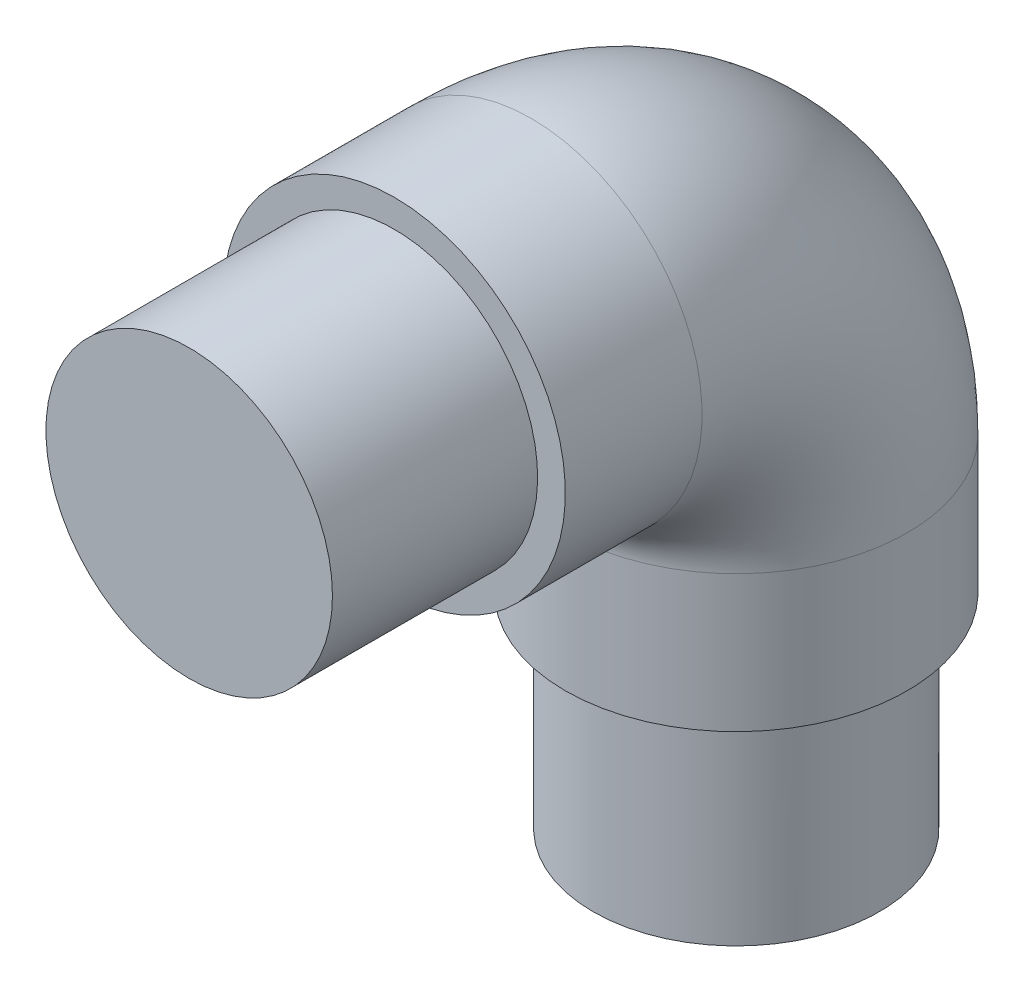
SolidWorks part; units mm, degrees
ref_plane "前视基准面" through (0, 0, 0) normal (0, 0, 1) x (1, 0, 0)
ref_plane "上视基准面" through (0, 0, 0) normal (0, 1, 0) x (1, 0, 0)
ref_plane "右视基准面" through (0, 0, 0) normal (1, 0, 0) x (0, 0, -1)
sketch "草图1" plane through (0, 0, 0) normal (0, 0, 1) x (1, 0, 0)
  circle A0 centre (0, 0) radius 10.475
  dimension "D1" = 20.95
extrude "凸台-拉伸1" add sketch "草图1" along normal blind 15
sketch "草图2" plane through (0, 0, 0) normal (1, 0, 0) x (0, 0, -1)
  line L0 (0, 0) -> (10, 0)
  line L1 (25, -15) -> (25, -25)
  arc A0 (10, 0) -> (25, -15) centre (10, -15) cw
  dimension "D1" = 15
sweep "扫描3" add path "草图2" parameters "D3"=25
sketch "草图70" plane through (0, -25, 0) normal (0, -1, 0) x (1, 0, 0)
  circle A0 centre (0, -25) radius 10.475
extrude "凸台-拉伸2" add sketch "草图70" along normal blind 15
